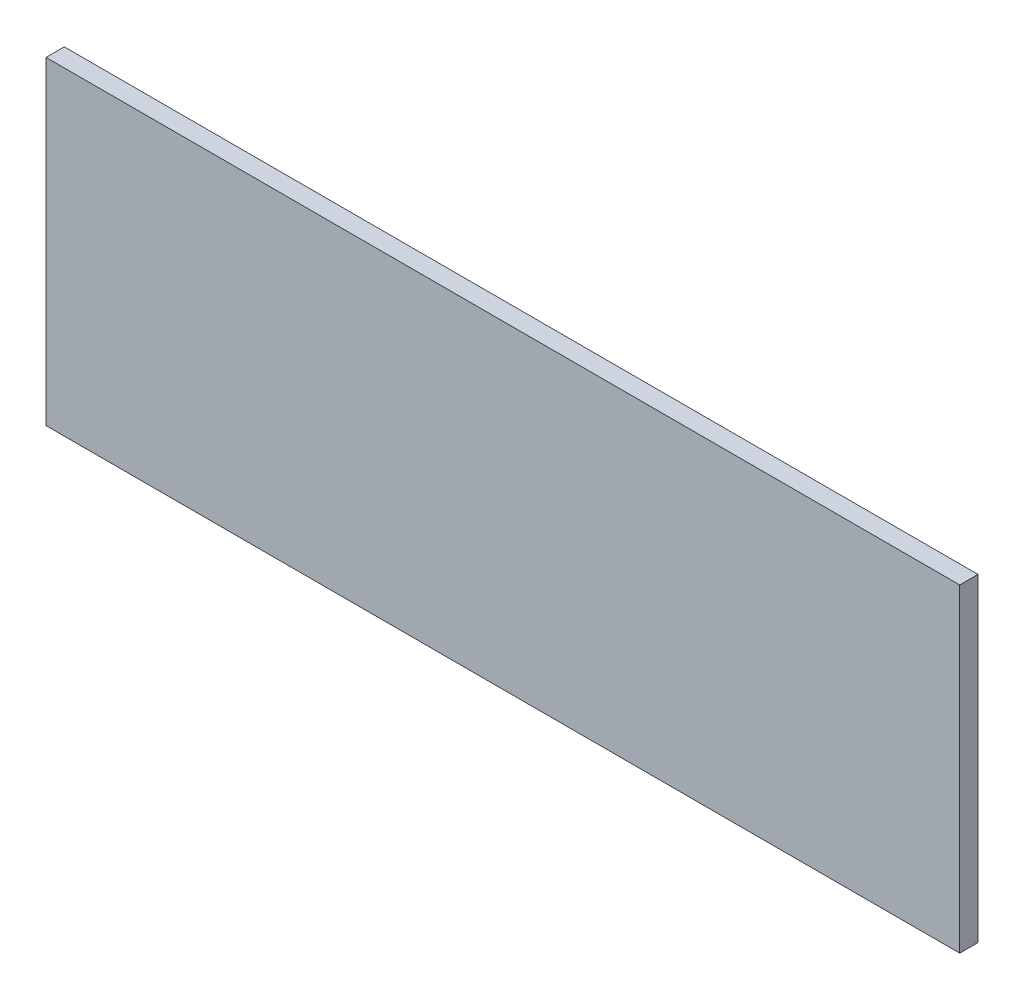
SolidWorks part; units mm, degrees
ref_plane "Alzado" through (0, 0, 0) normal (0, 0, 1) x (1, 0, 0)
ref_plane "Planta" through (0, 0, 0) normal (0, 1, 0) x (1, 0, 0)
ref_plane "Vista lateral" through (0, 0, 0) normal (1, 0, 0) x (0, 0, -1)
ref_plane "Plano1" through (0, 0, 10) normal (0, 0, 1) x (1, 0, 0)
sketch "Croquis3" plane through (0, 0, 10) normal (0, 0, 1) x (1, 0, 0)
  line L0 (-500, 173.6398) -> (0, 173.6398)
  line L1 (-500, 173.6398) -> (-500, -0.8556)
  line L2 (0, 173.6398) -> (0, -0.8556)
  line L3 (-500, -0.8556) -> (0, -0.8556)
  line L9 (-500, -0.8556) -> (0, -0.8556) construction
  point P0 (-500, 3.7011)
extrude "Saliente-Extruir3" add sketch "Croquis3" against normal blind 10
